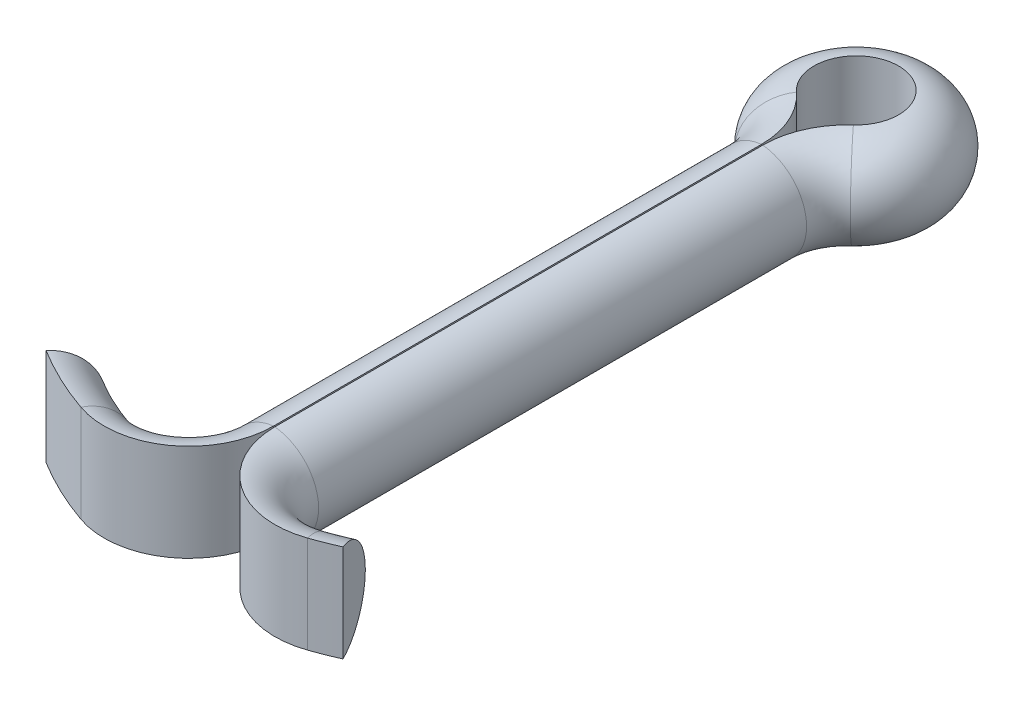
SolidWorks part; units mm, degrees
ref_plane "Спереди" through (0, 0, 0) normal (0, 0, 1) x (1, 0, 0)
ref_plane "Сверху" through (0, 0, 0) normal (0, 1, 0) x (1, 0, 0)
ref_plane "Справа" through (0, 0, 0) normal (1, 0, 0) x (0, 0, -1)
sketch "Эскиз1" plane through (0, 0, 0) normal (0, 1, 0) x (1, 0, 0)
  line L0 (0, -32.7032) -> (0, 33.9899) construction
  line L1 (-0.0127, 4.572) -> (-0.0127, -4.572)
  line L3 (0.0127, -4.572) -> (0.0127, 4.572)
  circle A0 centre (0, 0) radius 5.08 construction
  arc A1 (0.0127, -4.572) -> (2.1246, -6.0704) centre (1.6002, -4.572) ccw
  arc A2 (-0.0127, -4.572) -> (-2.1246, -6.0704) centre (-1.6002, -4.572) cw
  arc A3 (0.5334, 5.7476) -> (-0.5334, 5.7476) centre (0, 6.3354) ccw
  arc A4 (2.1246, -6.0704) -> (2.5996, -5.8827) centre (0, 0) ccw
  arc A5 (-2.1246, -6.0704) -> (-3.3714, -5.477) centre (0, 0) cw
  arc A6 (0.0127, 4.572) -> (0.5334, 5.7476) centre (1.6002, 4.572) cw
  arc A7 (-0.0127, 4.572) -> (-0.5334, 5.7476) centre (-1.6002, 4.572) ccw
  dimension "D1" = 10.16
  dimension "D2" = 0.7937
  dimension "D4" = 1.5875
  dimension "D7" = 1.5875
  dimension "D3" = 0.0254
  dimension "D5" = 4.572
  dimension "D6" = 4.572
ref_plane "Плоскость1" through (-3.3714, 0, 5.477) normal (-0.8516, 0, -0.5242) x (-0.5242, 0, 0.8516)
sketch "Эскиз2" plane through (-3.3714, 0, 5.477) normal (-0.8516, 0, -0.5242) x (-0.5242, 0, 0.8516)
  line L0 (0, 0) -> (-0.4062, 0) construction
  line L1 (0, -0.9094) -> (0, 0.9094)
  arc A0 (0, -0.9094) -> (0, 0.9094) centre (0.0951, 0) cw
  dimension "D1" = 0.9144
sweep "По траектории2" add profiles "Эскиз2" path "Эскиз1"
